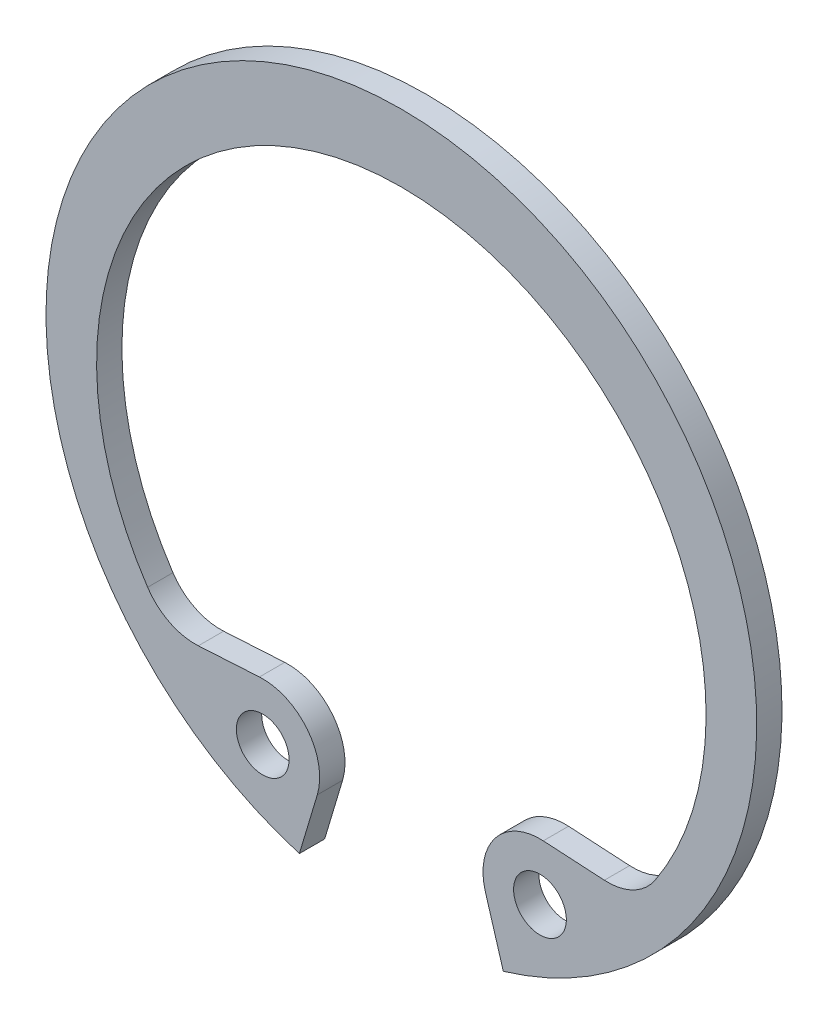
SolidWorks part; units mm, degrees
ref_plane "Face" through (0, 0, 0) normal (0, 0, 1) x (1, 0, 0)
ref_plane "Dessus" through (0, 0, 0) normal (0, 1, 0) x (1, 0, 0)
ref_plane "Droite" through (0, 0, 0) normal (1, 0, 0) x (0, 0, -1)
sketch "Esquisse1" plane through (0, 0, 0) normal (0, 0, 1) x (1, 0, 0)
  line L0 (0, 13.65) -> (0, 16.85) construction
  line L1 (3.986, -13.3058) -> (4.8354, -16.1413)
  line L2 (5.3183, -10.1399) -> (7.8265, -14.9221) construction
  line L3 (9.6263, -10.0038) -> (6.729, -9.8355)
  line L4 (-9.6263, -10.0038) -> (-6.729, -9.8355)
  line L5 (-3.986, -13.3058) -> (-4.8354, -16.1413)
  line L6 (4.8704, -13.3812) -> (5.8827, -16.1627) construction
  line L7 (-4.8704, -13.3812) -> (-5.8827, -16.1627) construction
  arc A0 (4.8354, -16.1413) -> (-4.8354, -16.1413) centre (0, 0) ccw
  arc A1 (12.0308, -8.8038) -> (-12.0308, -8.8038) centre (0, -0.8) ccw
  arc A2 (6.729, -9.8355) -> (3.986, -13.3058) centre (6.5724, -12.531) ccw
  arc A3 (9.6263, -10.0038) -> (12.0308, -8.8038) centre (9.7829, -7.3083) ccw
  circle A4 centre (6.5724, -12.531) radius 1.25
  arc A5 (-9.6263, -10.0038) -> (-12.0308, -8.8038) centre (-9.7829, -7.3083) cw
  circle A6 centre (-6.5724, -12.531) radius 1.25
  arc A7 (-6.729, -9.8355) -> (-3.986, -13.3058) centre (-6.5724, -12.531) cw
  arc A8 (5.8827, -16.1627) -> (-5.8827, -16.1627) centre (0, 0) ccw construction
  circle A9 centre (0, 0) radius 16 construction
  dimension "dgorge" = 33.7
  dimension "D3" = 0.8
  dimension "dtrou" = 2.5
  dimension "dext" = 34.4
  dimension "dn" = 32
  dimension "b" = 3.2
  dimension "a" = 5.4
  dimension "D5" = 70
  dimension "D7" = 33.353
  dimension "D9" = 40
extrude "Base-Extrusion" add sketch "Esquisse1" along normal blind 1.2
sketch "Esquisse2" plane through (0, 0, 0) normal (1, 0, 0) x (0, 0, -1)
  line L0 (-1.2, 16.85) -> (-1.2, 13.65)
  line L1 (-1.2, 16.85) -> (-1.2, 13.65)
  line L2 (-1.2, 16.85) -> (0, 16.85)
  line L3 (-1.2, 16.85) -> (0, 16.85)
  line L4 (0, 16.85) -> (0, 13.65)
  line L5 (0, 16.85) -> (0, 13.65)
equation "\"D3@Esquisse1\" = \"b@Esquisse1\"/4"
equation "\"D7@Esquisse1\" = 360-(360-\"D9@Esquisse1\")*\"dext@Esquisse1\"/\"dgorge@Esquisse1\""
